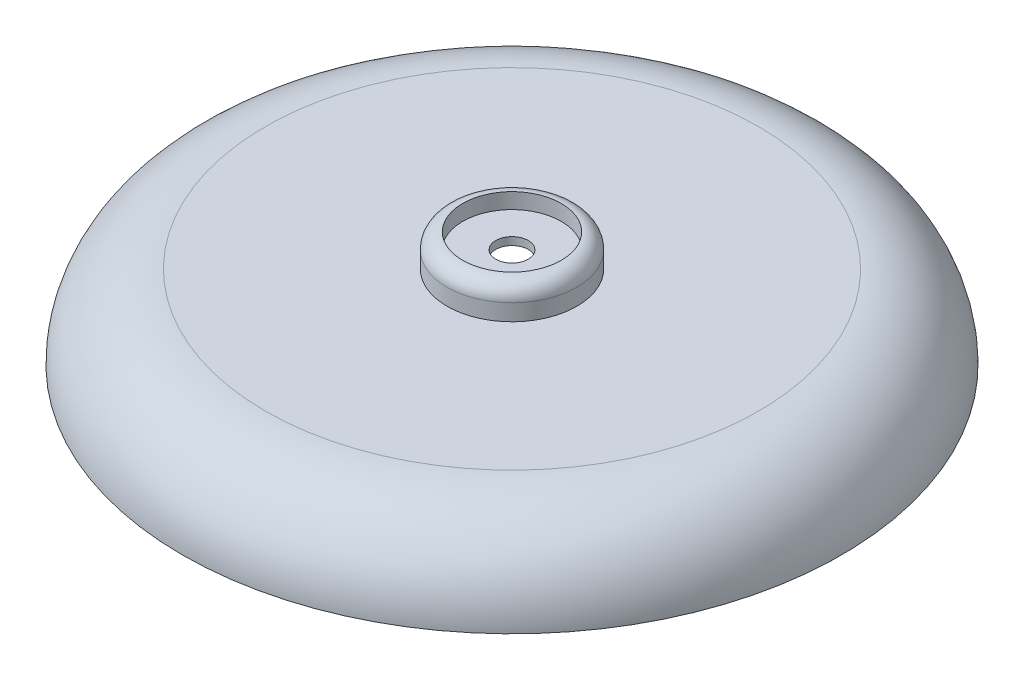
SolidWorks part; units mm, degrees
ref_plane "Front" through (0, 0, 0) normal (0, 0, 1) x (1, 0, 0)
ref_plane "Top" through (0, 0, 0) normal (0, 1, 0) x (1, 0, 0)
ref_plane "Right" through (0, 0, 0) normal (1, 0, 0) x (0, 0, -1)
sketch "Sketch1" plane through (0, 0, 0) normal (0, 0, 1) x (1, 0, 0)
  line L0 (0, 0) -> (0, 32.0492) construction
  line L1 (3.125, 0) -> (9.5, 0)
  line L2 (9.5, 0) -> (9.5, 3)
  line L3 (12.5, -3.175) -> (47.5, -3.175)
  line L4 (12.5, 0) -> (12.5, -3.175)
  line L5 (3.125, -1.5) -> (11, -1.5)
  line L6 (11, -4.675) -> (47.5, -4.675)
  line L7 (11, -1.5) -> (11, -4.675)
  line L8 (63.5, -19.175) -> (62, -19.175)
  line L9 (3.125, 0) -> (3.125, -1.5)
  arc A0 (9.5, 3) -> (12.5, 0) centre (9.5, 0) cw
  arc A1 (47.5, -3.175) -> (63.5, -19.175) centre (47.5, -19.175) cw
  arc A2 (47.5, -4.675) -> (62, -19.175) centre (47.5, -19.175) cw
  dimension "D2" = 3
  dimension "D3" = 16
  dimension "D1" = 19
  dimension "D4" = 127
  dimension "D5" = 3.175
  dimension "D7" = 6.25
  dimension "D6" = 1.5
revolve "Revolve1" add sketch "Sketch1" angle 360 about L0
sketch "spline_grid" plane through (0, 0, 0) normal (0, 0, 1) x (1, 0, 0)
  line L0 (6, 200) -> (6, 0) construction
  line L1 (0, 0) -> (45, 0) construction
  line L2 (0, 0) -> (0, 200) construction
  line L3 (0, 200) -> (45, 200) construction
  line L4 (45, 0) -> (45, 200) construction
  line L5 (19, 200) -> (19, 0) construction
  line L6 (34, 200) -> (34, 0) construction
  line L7 (0, 100) -> (45, 100) construction
other "AlignGroup1" parameters "D1"=61.3821, "D2"=0, "D3"=31.75, "D7"=0, "D8"=6.35, "D9"=19.05, "D10"=33.655, "D11"=44.45, "D4"=19, "D5"=34, "D6"=45
